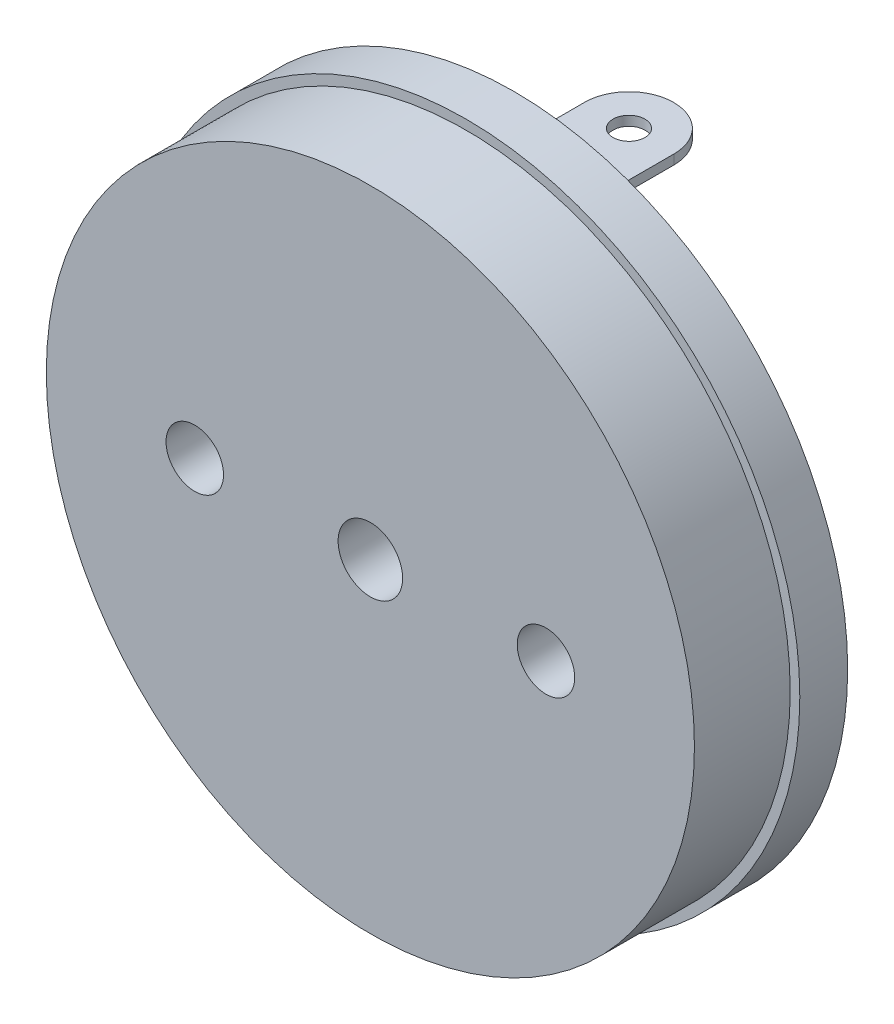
SolidWorks part; units mm, degrees
ref_plane "Face" through (0, 0, 0) normal (0, 0, 1) x (1, 0, 0)
ref_plane "Dessus" through (0, 0, 0) normal (0, 1, 0) x (1, 0, 0)
ref_plane "Droite" through (0, 0, 0) normal (1, 0, 0) x (0, 0, -1)
sketch "Esquisse1" plane through (0, 0, 0) normal (0, 0, 1) x (1, 0, 0)
  circle A0 centre (0, 0) radius 10.45
extrude "Base-Extrusion" add sketch "Esquisse1" along normal blind 1.5
sketch "Esquisse2" plane through (0, 0, 1.5) normal (0, 0, 1) x (1, 0, 0)
  circle A0 centre (0, 0) radius 10.15
extrude "Boss.-Extru.1" add sketch "Esquisse2" along normal blind 3
sketch "Esquisse4"
  line L0 (-12.0736, 0) -> (12.0376, 0) construction
  line L1 (-5.5, 5.1641) -> (-5.5, -4.6243) construction
  line L2 (5.5, 5.1641) -> (5.5, -4.6243) construction
  line L3 (0, 5.7399) -> (0, -6.8555) construction
  circle A0 centre (-5.5, 0) radius 0.9
  circle A1 centre (5.5, 0) radius 0.9
extrude "Enlèv. mat.-Extru.1" cut sketch "Esquisse3" against normal through all
sketch "Esquisse3" plane through (0, 0, 4.5) normal (0, 0, 1) x (1, 0, 0)
  circle A0 centre (0, 0) radius 1.01
extrude "Enlèv. mat.-Extru.2" cut sketch "Esquisse4" against normal through all
sketch "Esquisse6" plane through (0, 0, 0) normal (0, 0, -1) x (-1, 0, 0)
  circle A0 centre (0, 0) radius 3.08
extrude "Boss.-Extru.3" add sketch "Esquisse6" along normal blind 2
sketch "Esquisse7" plane through (0, 0, 0) normal (0, 0, -1) x (-1, 0, 0)
  line L0 (0, 12.1456) -> (0, -13.4051) construction
  line L1 (-2.609, 7.5) -> (3.5807, 7.5) construction
  line L2 (-8.0431, 0) -> (8.3669, 0) construction
  line L3 (-1.4, 8.9067) -> (-1.4, 6.0638) construction
  line L4 (1.4, 8.9067) -> (1.4, 6.0638) construction
  line L5 (1.4, 7.65) -> (1.4, 7.35)
  line L6 (-1.4, 7.65) -> (1.4, 7.65)
  line L7 (-1.4, 7.35) -> (1.4, 7.35)
  line L8 (-1.4, 7.65) -> (-1.4, 7.35)
  line L9 (-1.4, -7.65) -> (-1.4, -7.35)
  line L10 (-1.4, -7.35) -> (1.4, -7.35)
  line L11 (-1.4, -7.65) -> (1.4, -7.65)
  line L12 (1.4, -7.65) -> (1.4, -7.35)
extrude "Boss.-Extru.4" add sketch "Esquisse7" along normal blind 5
fillet "Congé1" radius 1.39
sketch "Esquisse8" plane through (0, 7.65, 0) normal (0, 1, 0) x (-1, 0, 0)
  line L0 (0, 0.762) -> (0, -6.0163) construction
  line L1 (-2.1389, -3.6) -> (2.329, -3.6) construction
  circle A0 centre (0, -3.6) radius 0.5
extrude "Enlèv. mat.-Extru.3" cut sketch "Esquisse8" against normal through all
sketch "Esquisse9" plane through (0, 0, 0) normal (0, 0, -1) x (-1, 0, 0)
  line L1 (-2.8164, -7.9192) -> (-4.9356, -7.9192)
  line L2 (-2.8164, -7.9192) -> (-2.8164, -5.6606)
  line L3 (-2.8164, -5.6606) -> (-4.9356, -5.6606)
  line L4 (-4.9356, -7.9192) -> (-4.9356, -5.6606)
  circle A0 centre (3.625, 7.0827) radius 1.1292
extrude "Enlèv. mat.-Extru.4" cut sketch "Esquisse9" against normal blind 1
